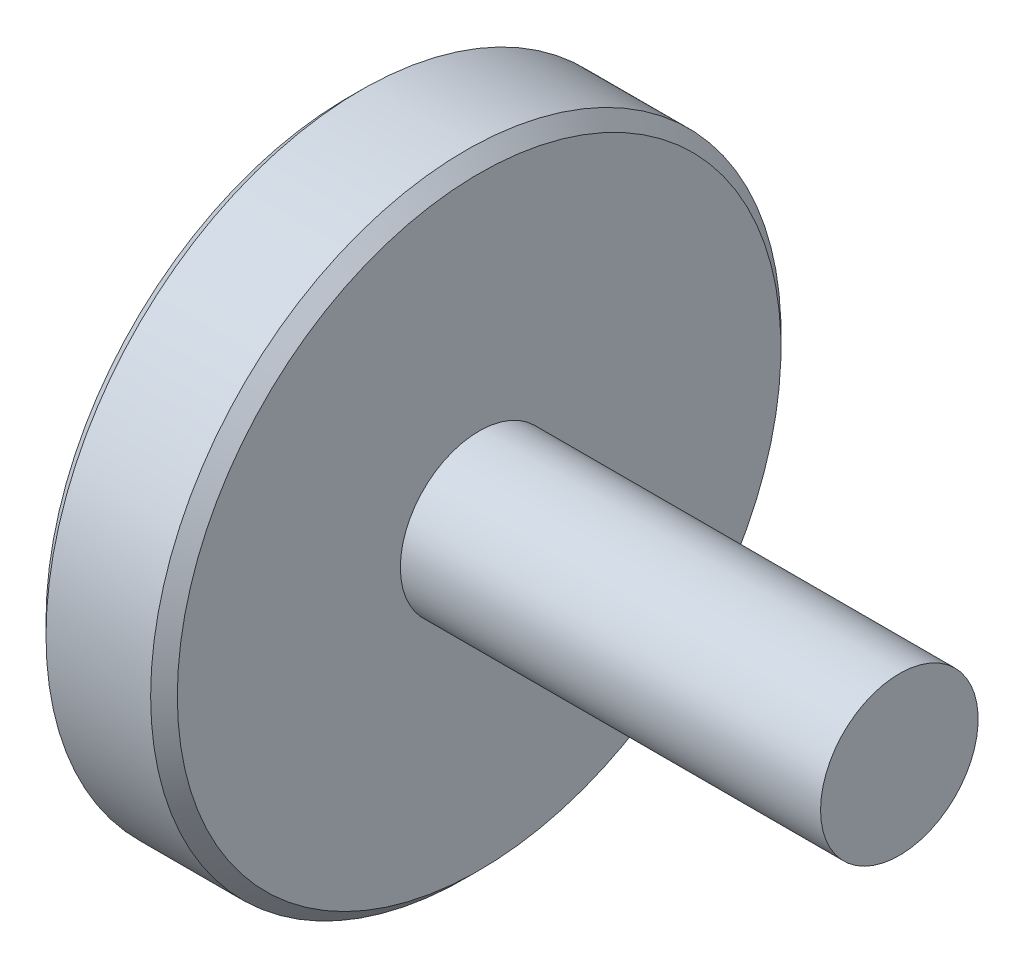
SolidWorks part; units mm, degrees
ref_plane "Front Plane" through (0, 0, 0) normal (0, 0, 1) x (1, 0, 0)
ref_plane "Top Plane" through (0, 0, 0) normal (0, 1, 0) x (1, 0, 0)
ref_plane "Right Plane" through (0, 0, 0) normal (1, 0, 0) x (0, 0, -1)
ref_plane "Plane1" through (0, 0, 0) normal (0, 0, -1) x (-1, 0, 0)
sketch "Sketch1" plane through (0, 0, 0) normal (0, 0, -1) x (-1, 0, 0)
  line L0 (-10.5, 1.5) -> (-10.5, 0)
  line L1 (-10.5, 0) -> (0, 0)
  line L2 (0, 0) -> (0, 5.746)
  line L3 (0, 5.746) -> (-0.254, 6)
  line L4 (-0.254, 6) -> (-2.246, 6)
  line L5 (-2.246, 6) -> (-2.5, 5.746)
  line L6 (-2.5, 5.746) -> (-2.5, 1.5)
  line L7 (-2.5, 1.5) -> (-10.5, 1.5)
  line L8 (-10.5, 0) -> (0, 0) construction
revolve "Revolve1" add sketch "Sketch1" angle 360 about L8
